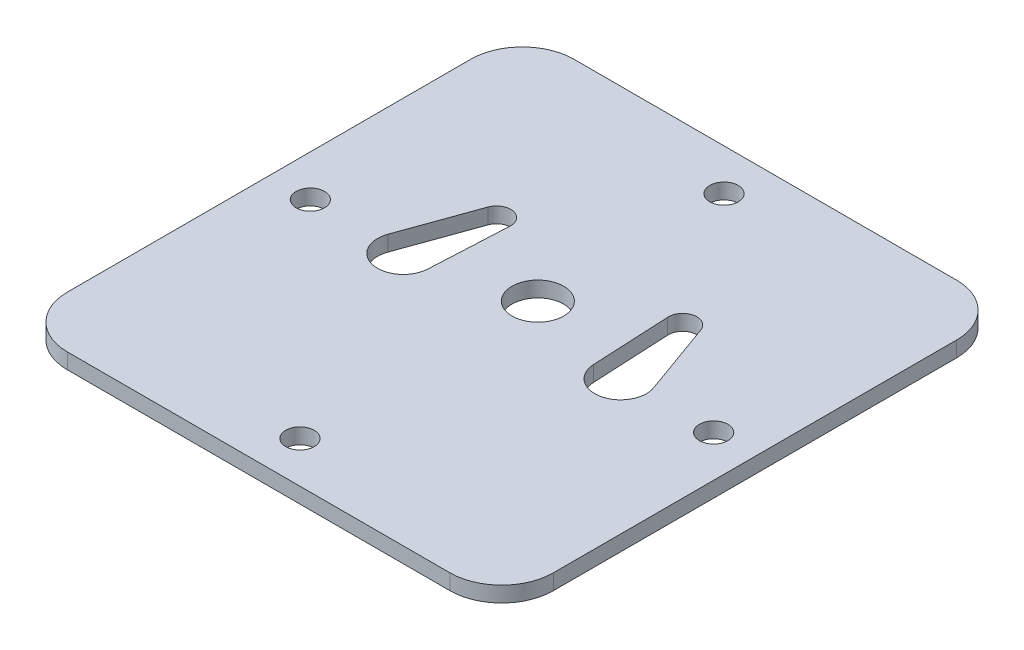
SolidWorks part; units mm, degrees
ref_plane "Front Plane" through (0, 0, 0) normal (0, 0, 1) x (1, 0, 0)
ref_plane "Top Plane" through (0, 0, 0) normal (0, 1, 0) x (1, 0, 0)
ref_plane "Right Plane" through (0, 0, 0) normal (1, 0, 0) x (0, 0, -1)
sketch "Sketch1" plane through (0, 0, 0) normal (0, 1, 0) x (1, 0, 0)
  line L0 (47, 98) -> (47, 0) construction
  line L1 (10, 0) -> (84, 0)
  line L2 (0, 10) -> (0, 88)
  line L3 (10, 98) -> (84, 98)
  line L4 (94, 10) -> (94, 88)
  line L5 (94, 49) -> (0, 49) construction
  line L6 (26.4121, 64.9301) -> (21.2947, 50.6911)
  line L7 (31.7466, 63.8632) -> (30.9938, 48.7512)
  line L8 (62.2534, 63.8632) -> (63.0062, 48.7512)
  line L9 (67.5879, 64.9301) -> (72.7053, 50.6911)
  arc A0 (0, 88) -> (10, 98) centre (10, 88) cw
  arc A1 (10, 0) -> (0, 10) centre (10, 10) cw
  arc A2 (94, 10) -> (84, 0) centre (84, 10) cw
  arc A3 (84, 98) -> (94, 88) centre (84, 88) cw
  circle A4 centre (47, 90) radius 2.75
  circle A5 centre (86, 49) radius 2.75
  circle A6 centre (47, 8) radius 2.75
  circle A7 centre (8, 49) radius 2.75
  circle A8 centre (47, 54) radius 5
  arc A9 (31.7466, 63.8632) -> (26.4121, 64.9301) centre (29, 64) ccw
  arc A10 (21.2947, 50.6911) -> (30.9938, 48.7512) centre (26, 49) ccw
  arc A11 (72.7053, 50.6911) -> (63.0062, 48.7512) centre (68, 49) cw
  arc A12 (62.2534, 63.8632) -> (67.5879, 64.9301) centre (65, 64) cw
  point P7 (0, 98)
  point P10 (0, 0)
  point P13 (94, 0)
  dimension "D3" = 10
  dimension "D4" = 8
  dimension "D5" = 8
  dimension "D6" = 8
  dimension "D7" = 5.5
  dimension "D8" = 8
  dimension "D9" = 5
  dimension "D10" = 10
  dimension "D11" = 5.5
  dimension "D12" = 3
  dimension "D13" = 15
  dimension "D14" = 10
  dimension "D15" = 21
  dimension "D1" = 98
  dimension "D2" = 94
extrude "Extrude1" add sketch "Sketch1" along normal blind 3
